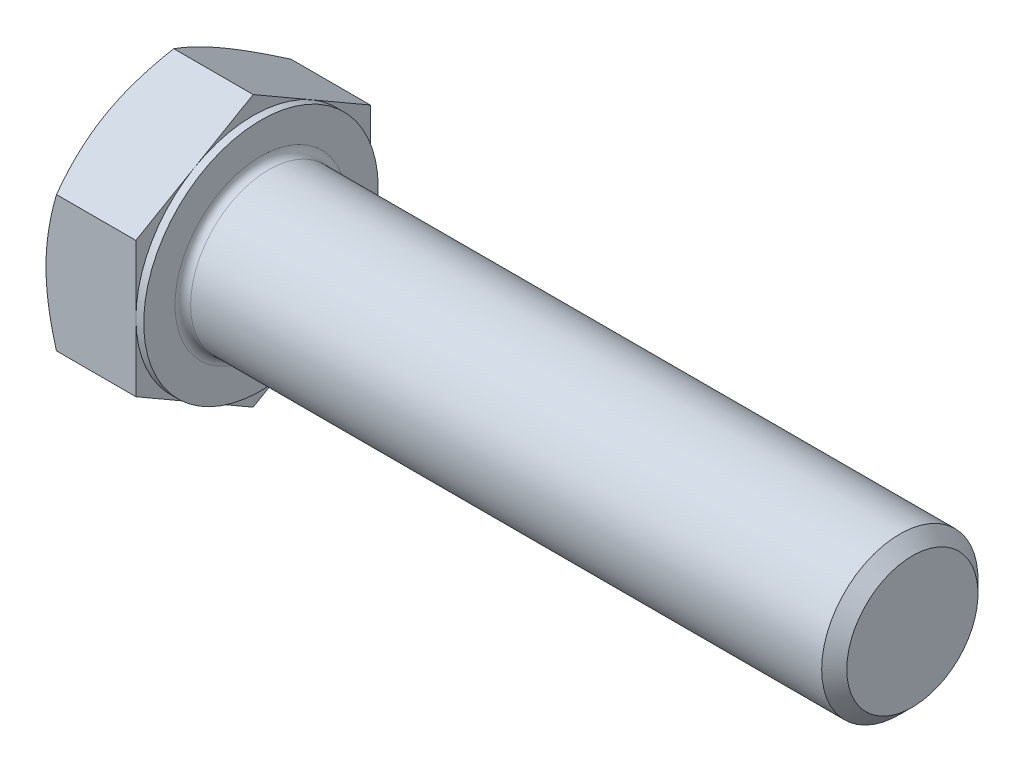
SolidWorks part; units mm, degrees
ref_plane "Plane1" through (0, 0, 0) normal (0, 0, 1) x (1, 0, 0)
ref_plane "Plane2" through (0, 0, 0) normal (0, 1, 0) x (1, 0, 0)
ref_plane "Plane3" through (0, 0, 0) normal (1, 0, 0) x (0, 0, -1)
sketch "Sketch1" plane through (0, 0, 0) normal (1, 0, 0) x (0, 0, -1)
  line L0 (9, 5.1962) -> (9, -5.1962)
  line L1 (-9, 5.1962) -> (-9, -5.1962)
  line L2 (9, -5.1962) -> (0, -10.3923)
  line L3 (0, -10.3923) -> (-9, -5.1962)
  line L4 (9, 5.1962) -> (0, 10.3923)
  line L5 (0, 10.3923) -> (-9, 5.1962)
  dimension "Width_flats" = 18
  dimension "D2" = 120
  dimension "D3" = 9
  dimension "D4" = 9
  dimension "D5" = 9
extrude "BaseHead" add sketch "Sketch1" along normal blind 7.5
sketch "BodySke" plane through (0, 0, 0) normal (0, 0, 1) x (1, 0, 0)
  line L0 (0, 5.1962) -> (0, -5.1962) construction
  line L1 (0, 0) -> (57.5, 0)
  line L2 (0, 0) -> (0, 6)
  line L3 (0, 6) -> (56.536, 6)
  line L4 (57.5, 0) -> (57.5, 5.036)
  line L5 (7.5, 10.3923) -> (7.5, 5.1962) construction
  line L6 (57.5, 5.036) -> (56.536, 6)
  line L7 (0, 0) -> (96.52, 0) construction
  line L8 (57.5, -5.036) -> (56.536, -6) construction
  line L9 (0, -6) -> (56.536, -6) construction
  line L10 (9.25, 15.24) -> (9.25, -1.27) construction
  line L11 (27.5, 15.24) -> (27.5, -1.27) construction
  line L12 (7.5, 5.1962) -> (7.5, -5.1962) construction
  dimension "Length" = 50
  dimension "Body_ch_ang" = 45
  dimension "Diameter" = 12
  dimension "Minor_dia" = 10.072
  dimension "Advance" = 1.75
  dimension "Thread_nom" = 30
revolve "BaseBody" add sketch "BodySke"
fillet "HeadFillet" radius 0.6 1 edges at (7.5, 0, -6)
sketch "Sketch3" plane through (0, 0, 0) normal (0, 0, 1) x (1, 0, 0)
  line L0 (0, 9) -> (3.6906, 15.3923)
  line L1 (0, 10.3923) -> (0, 5.1962) construction
  line L2 (3.6906, 15.3923) -> (3.6906, 20.3923)
  line L3 (3.6906, 20.3923) -> (-10, 20.3923)
  line L4 (-10, 20.3923) -> (-10, 9)
  line L5 (-10, 9) -> (0, 9)
  line L6 (0, 0) -> (99.06, 0) construction
  line L7 (7.5, 10.3923) -> (0, 10.3923) construction
  dimension "D1" = 9
  dimension "D2" = 5
  dimension "D3" = 10
  dimension "D4" = 5
  dimension "Head_ch_ang" = 30
revolve "HeadChamfer" cut sketch "Sketch3" angle 360 about L6
sketch "Sketch4" plane through (0, 0, 0) normal (0, 0, 1) x (1, 0, 0)
  line L1 (7.5, 10.3923) -> (7.5, 5.1962) construction
  line L2 (7.5, 9) -> (6.9, 9)
  line L3 (7.5, 9) -> (7.5, 20.3923)
  line L4 (7.5, 20.3923) -> (6.9, 20.3923)
  line L5 (0, 0) -> (95.25, 0) construction
  line L6 (0, 0) -> (96.52, 0) construction
  line L7 (6.9, 9) -> (6.9, 20.3923)
  line L8 (7.5, 10.3923) -> (0.8038, 10.3923) construction
  dimension "D1" = 18
  dimension "D2" = 10
  dimension "Bearing_ht" = 0.6
revolve "BearingFace" cut sketch "Sketch4" angle 360 about L5
sketch "ThdSchSke" plane through (0, 0, 0) normal (0, 0, 1) x (1, 0, 0)
  line L0 (27.5, -5.036) -> (26.825, -6)
  line L1 (27.5, -5.036) -> (28.175, -6)
  line L2 (28.175, -6) -> (28.175, -7.5)
  line L3 (-3.175, 0) -> (5.1513, 0) construction
  line L5 (28.175, -7.5) -> (26.825, -7.5)
  line L6 (26.825, -7.5) -> (26.825, -6)
  dimension "Thread_minor" = 10.072
  dimension "Diameter" = 12
  dimension "Start" = 27.5
  dimension "SideAngle" = 55
  dimension "VeeAngle" = 70
  dimension "Overcut" = 15
revolve "ThreadSchematic" [suppressed] cut sketch "ThdSchSke" angle 360 about L3
pattern_linear "ThdSchPat" [suppressed]
equation "\"D3@Sketch1\" = \"Width_flats@Sketch1\" / 2"
equation "\"D4@Sketch1\" = \"D3@Sketch1\""
equation "\"D5@Sketch1\" = \"D4@Sketch1\""
equation "\"Thread_minor@ThreadCosmetic\" = \"Minor_dia@BodySke\""
equation "\"D1@Sketch3\" = \"Width_flats@Sketch1\" / 2"
equation "\"D1@Sketch4\" = \"Width_flats@Sketch1\""
equation "\"Thread_length@ThreadCosmetic\" = ((sgn( (\"Length@BodySke\" - \"Advance@BodySke\" ) - \"Thread_nom@BodySke\" )-1)*( (\"Length@BodySke\" - \"Advance@BodySke\" ) - \"Thread_nom@BodySke\" ))/-2+ \"Thread_nom@BodySke\""
equation "\"Thread_minor@ThdSchSke\" = \"Minor_dia@BodySke\""
equation "\"Diameter@ThdSchSke\" = \"Diameter@BodySke\""
equation "\"Overcut@ThdSchSke\" = \"Diameter@BodySke\" * 1.25"
equation "\"Start@ThdSchSke\" = \"Head_ht@BaseHead\" + \"Length@BodySke\" - \"Thread_length@ThreadCosmetic\"  '---Non-countersunk---"
equation "\"Num_threads@ThdSchPat\" = int( \"Thread_length@ThreadCosmetic\" / \"Advance@BodySke\" + 0.999 )  + 1"
equation "\"Advance@ThdSchPat\" = \"Thread_length@ThreadCosmetic\" /  (\"Num_threads@ThdSchPat\" - 1) 'relax it"
equation "\"Num_threads@ThdSchPat\" = \"Num_threads@ThdSchPat\" - sgn( \"Num_threads@ThdSchPat\" - 1) '---chamfered tips only---"
